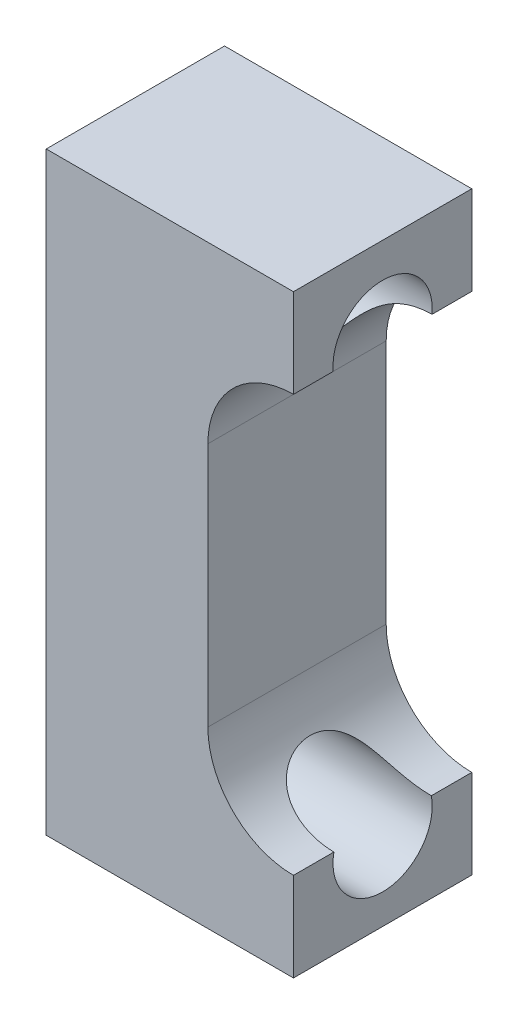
SolidWorks part; units mm, degrees
ref_plane "Front Plane" through (0, 0, 0) normal (0, 0, 1) x (1, 0, 0)
ref_plane "Top Plane" through (0, 0, 0) normal (0, 1, 0) x (1, 0, 0)
ref_plane "Right Plane" through (0, 0, 0) normal (1, 0, 0) x (0, 0, -1)
sketch "Sketch1" plane through (0, 0, 0) normal (0, 0, 1) x (1, 0, 0)
  line L0 (0, 16) -> (-1.208, 16)
  line L1 (0, 16) -> (12, 16)
  line L2 (-1.208, 16) -> (-1.208, -15.75)
  line L3 (0, -15.75) -> (12, -15.75)
  line L4 (12, 16) -> (12, -15.75)
  line L5 (-1.208, -15.75) -> (0, -15.75)
  dimension "D1" = 12
  dimension "D2" = 13.208
  dimension "D4" = 31.75
  dimension "D5" = 31.75
extrude "Boss-Extrude1" add sketch "Sketch1" along normal mid plane 9.525
ref_plane "Plane2" through (-13.4, 0, 0) normal (1, 0, 0) x (0, 0, -1)
sketch "Sketch3" plane through (-13.4, 0, 0) normal (1, 0, 0) x (0, 0, -1)
  line L0 (0, 17.0024) -> (0, -17.2089) construction
  line L1 (-3.8575, 0) -> (5.5386, 0) construction
  line L2 (-6.0602, 11.5) -> (4.9535, 11.5) construction
  line L3 (-5.4407, -11.5) -> (5.4407, -11.5) construction
  circle A0 centre (0, 11.5) radius 1.9812
  circle A1 centre (0, -11.5) radius 1.9812
  dimension "D3" = 3.9624
  dimension "D1" = 11.5
  dimension "D2" = 11.5
extrude "Cut-Extrude1" [suppressed] cut sketch "Sketch3" against normal through all
ref_plane "Plane1" through (-13.4, 0, 0) normal (1, 0, 0) x (0, 0, -1)
sketch "Sketch4" [suppressed] plane through (-15.875, 0, 0) normal (1, 0, 0) x (0, 0, -1)
  circle A0 centre (0, 12.7) radius 2.8702
  circle A1 centre (0, -12.7) radius 2.8702
  dimension "D1" = 5.7404
  dimension "D2" = 5.7404
extrude "Cut-Extrude2" [suppressed] cut sketch "Sketch4" along normal blind 6.35
hole_wizard "M5 Clearance Hole1" positions "3DSketch1" profile "Sketch5" hole size "M5" standard "Ansi Metric"
sketch3d "3DSketch1"
  point P0 (-13.4, 11.5, 0)
  point P3 (-13.4, -11.5, 0)
sketch "Sketch5" plane through (-13.4, 11.5, 0) normal (0, 1, 0) x (0, 0, 1)
  line L0 (0, 0) -> (0, 26.9923)
  line L1 (0, 26.9923) -> (2.65, 25.4)
  line L2 (2.65, 25.4) -> (2.65, 0)
  line L5 (2.65, 0) -> (0, 0)
  line L10 (0, 26.9923) -> (-2.65, 25.4) construction
  line L11 (0, -6.35) -> (0, 107.95) construction
  dimension "Hole Dia." = 5.3
  dimension "Hole Depth" = 25.4
  dimension "Drill Angle" = 118
sketch "Sketch6" plane through (0, 0, 4.7625) normal (0, 0, 1) x (1, 0, 0)
  line L0 (12, -15.75) -> (12, 16) construction
  line L1 (12, 11.2502) -> (19.9548, 11.2502)
  line L2 (7.428, 6.6782) -> (7.428, -6.4282)
  line L3 (12, -11.0002) -> (19.9548, -11.0002)
  line L4 (19.9548, 11.2502) -> (19.9548, -11.0002)
  line L5 (-1.208, -15.75) -> (12, -15.75) construction
  line L6 (12, 16) -> (-1.208, 16) construction
  arc A0 (7.428, -6.4282) -> (12, -11.0002) centre (12, -6.4282) ccw
  arc A1 (12, 11.2502) -> (7.428, 6.6782) centre (12, 6.6782) ccw
  dimension "D4" = 4.572
  dimension "D1" = 4.572
  dimension "D2" = 4.7498
  dimension "D3" = 4.7498
extrude "Cut-Extrude3" cut sketch "Sketch6" against normal through all
